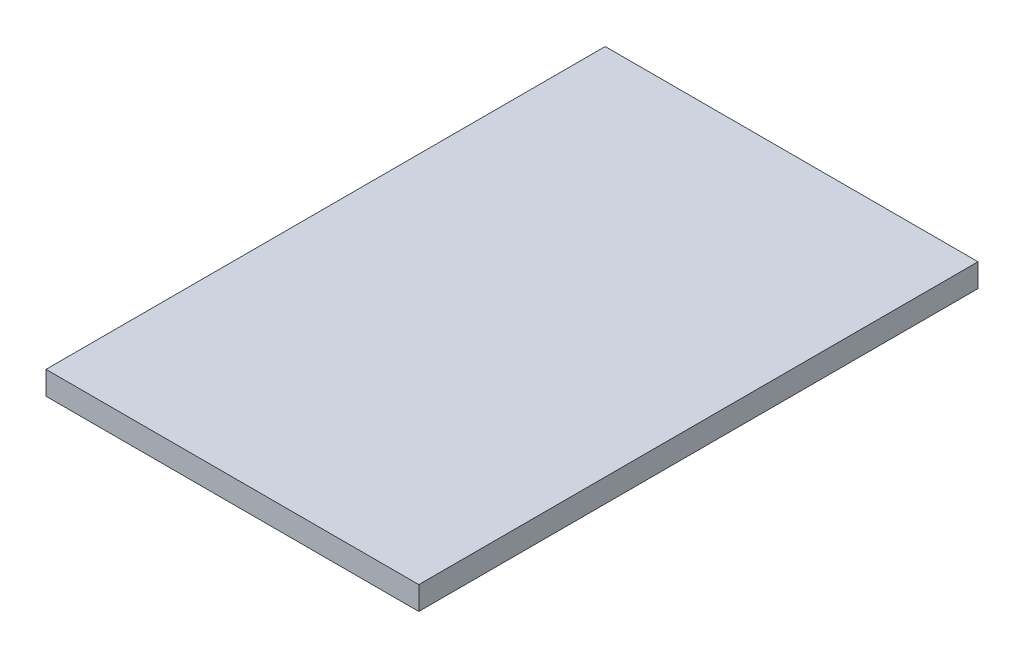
SolidWorks part; units mm, degrees
ref_plane "Front Plane" through (0, 0, 0) normal (0, 0, 1) x (1, 0, 0)
ref_plane "Top Plane" through (0, 0, 0) normal (0, 1, 0) x (1, 0, 0)
ref_plane "Right Plane" through (0, 0, 0) normal (1, 0, 0) x (0, 0, -1)
sketch "Sketch1" plane through (0, 0, 0) normal (0, 1, 0) x (1, 0, 0)
  line L1 (25.4, -38.1) -> (-25.4, -38.1)
  line L2 (25.4, -38.1) -> (25.4, 38.1)
  line L3 (25.4, 38.1) -> (-25.4, 38.1)
  line L4 (-25.4, -38.1) -> (-25.4, 38.1)
  line L5 (25.4, -38.1) -> (-25.4, 38.1) construction
  line L6 (25.4, 38.1) -> (-25.4, -38.1) construction
  point P0 (0, 0)
  dimension "D1" = 50.8
  dimension "D2" = 76.2
extrude "Boss-Extrude1" add sketch "Sketch1" along normal blind 3.175
